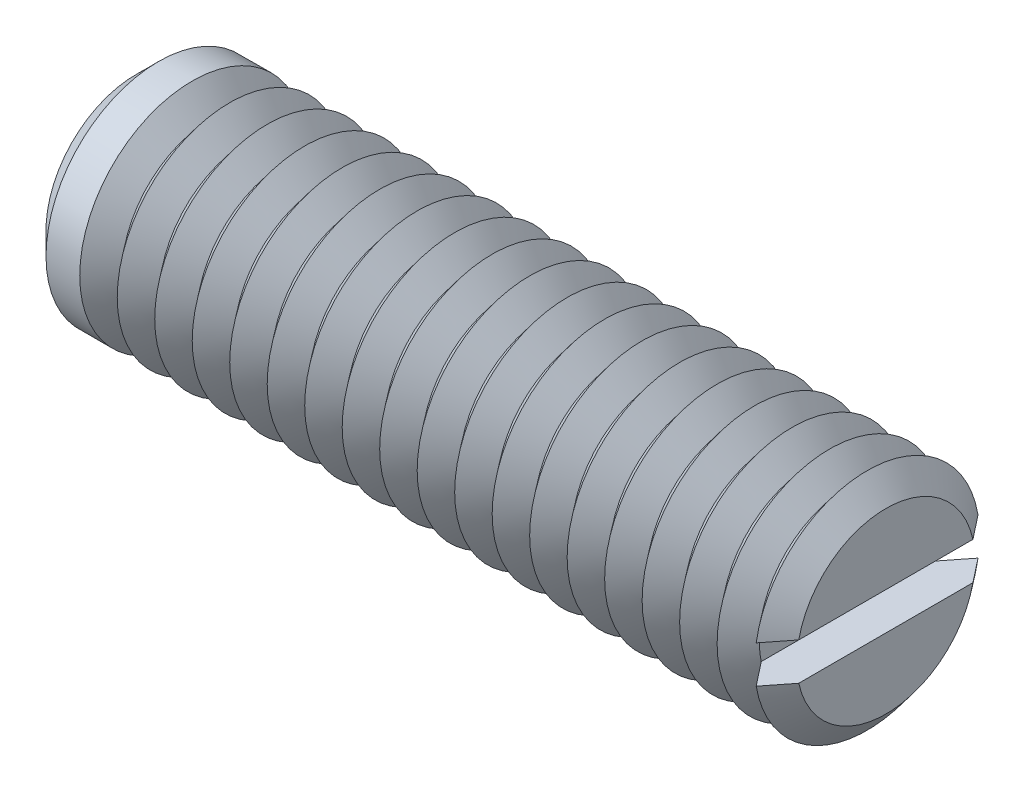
SolidWorks part; units mm, degrees
ref_plane "Front Plane" through (0, 0, 0) normal (0, 0, 1) x (1, 0, 0)
ref_plane "Top Plane" through (0, 0, 0) normal (0, 1, 0) x (1, 0, 0)
ref_plane "Right Plane" through (0, 0, 0) normal (1, 0, 0) x (0, 0, -1)
sketch "Sketch1" plane through (0, 0, 0) normal (1, 0, 0) x (0, 0, -1)
  circle A0 centre (0, 0) radius 3
  dimension "D1" = 6
extrude "Extrude1" add sketch "Sketch1" along normal mid plane 20
sketch "Sketch2" plane through (0, 0, 0) normal (0, 0, 1) x (1, 0, 0)
  line L0 (10, 0.5) -> (9, 0.5)
  line L1 (10, -3) -> (10, 3) construction
  line L2 (9, 0.5) -> (9, -0.5)
  line L3 (0, 0) -> (50000, 0) construction
  line L4 (10, -0.5) -> (9, -0.5)
  line L5 (10, -0.5) -> (10, 0.5)
  point P9 (9, 0)
  dimension "D1" = 1
extrude "Extrude2" cut sketch "Sketch2" against normal mid plane 9
chamfer "Chamfer1" distance 0.6 angle 45 1 edges at (-10, 0, -3)
sketch "Sketch3" plane through (0, 0, 0) normal (0, 0, 1) x (1, 0, 0)
  line L0 (0, 0) -> (30.9602, 0) construction
  line L1 (9.5, -3) -> (10.5, -3)
  line L2 (-9.4, -3) -> (10, -3) construction
  line L3 (10.5, -3) -> (10, -2.3755)
  line L4 (10, -3) -> (10, -0.5) construction
  line L5 (10, -2.3755) -> (9.5, -3)
  dimension "D1" = 1
  dimension "D2" = 0.8
revolve "Cut-Revolve1" cut sketch "Sketch3" angle 360 about L0
pattern_linear "LPattern1" count 19 spacing 1 along (-1, 0, 0) of "Cut-Revolve1"
equation "\"D2@Sketch3\" = \"D1@Sketch3\"*0.8"
